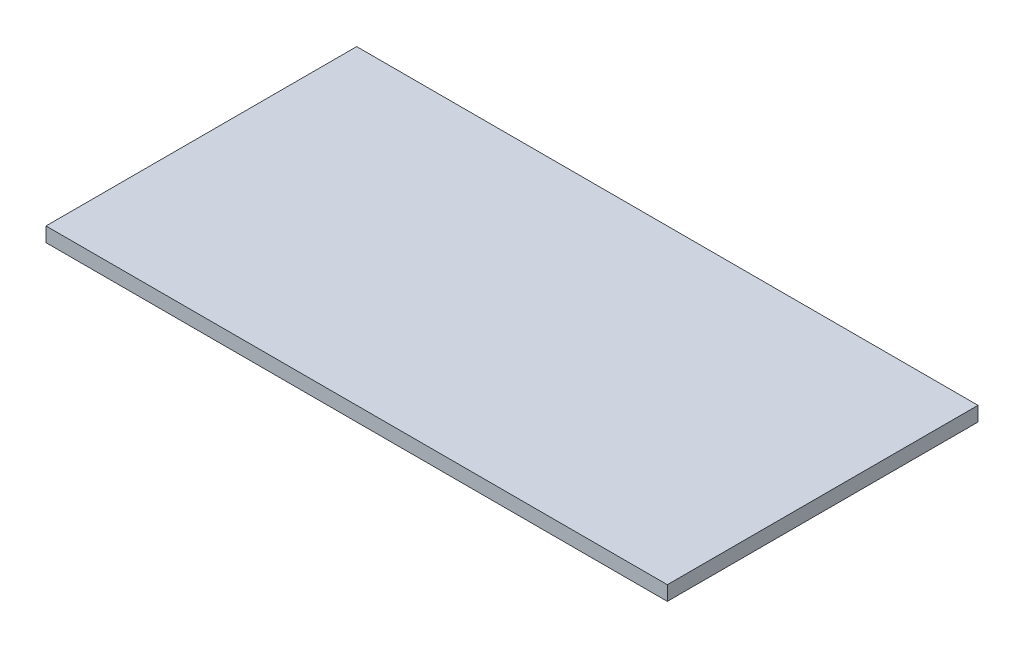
SolidWorks part; units mm, degrees
ref_plane "Front Plane" through (0, 0, 0) normal (0, 0, 1) x (1, 0, 0)
ref_plane "Top Plane" through (0, 0, 0) normal (0, 1, 0) x (1, 0, 0)
ref_plane "Right Plane" through (0, 0, 0) normal (1, 0, 0) x (0, 0, -1)
sketch "Sketch1" plane through (0, 0, 0) normal (0, 1, 0) x (1, 0, 0)
  line L1 (-560, 280) -> (560, 280)
  line L2 (-580, 260) -> (-580, -260)
  line L3 (-560, -280) -> (560, -280)
  line L4 (580, 260) -> (580, -260)
  line L5 (-580, 280) -> (580, -280) construction
  line L6 (-580, -280) -> (580, 280) construction
  arc A0 (560, 280) -> (580, 260) centre (560, 260) cw
  arc A1 (-580, -260) -> (-560, -280) centre (-560, -260) ccw
  arc A2 (-560, 280) -> (-580, 260) centre (-560, 260) ccw
  arc A3 (560, -280) -> (580, -260) centre (560, -260) ccw
  point P0 (0, 0)
  dimension "D3" = 20
  dimension "D1" = 560
  dimension "D2" = 1160
extrude "Boss-Extrude1" add sketch "Sketch1" against normal blind 5 draft 45
sketch "Sketch2" plane through (0, 0, 0) normal (0, 1, 0) x (1, 0, 0)
  line L1 (-600, 300) -> (600, 300)
  line L2 (-600, 300) -> (-600, -300)
  line L3 (-600, -300) -> (600, -300)
  line L4 (600, 300) -> (600, -300)
  line L5 (-600, 300) -> (600, -300) construction
  line L6 (-600, -300) -> (600, 300) construction
  point P0 (0, 0)
  dimension "D1" = 600
  dimension "D2" = 1200
extrude "Boss-Extrude2" add sketch "Sketch2" along normal blind 28
fillet "Fillet1" radius 2 16 edges at (-574.1421, 0, 274.1421) (-580, 0, 0) (-574.1421, 0, -274.1421) (0, 0, -280) (574.1421, 0, -274.1421) (580, 0, 0) (574.1421, 0, 274.1421) (0, -5, -275) (-570.6066, -5, -270.6066) (-575, -5, 0) (-570.6066, -5, 270.6066) (0, -5, 275) (570.6066, -5, 270.6066) (575, -5, 0) (570.6066, -5, -270.6066) (0, 0, 280)
sketch "Orientation Sketch" plane through (0, 0, 0) normal (0, -1, 0) x (-1, 0, 0)
  line L0 (580.8284, 260) -> (580.8284, -260) construction
  line L1 (560, -280.8284) -> (-560, -280.8284) construction
  line L2 (-580.8284, -260) -> (-580.8284, 260) construction
  line L3 (-560, 280.8284) -> (560, 280.8284) construction
  line L4 (-600, -300) -> (-600, 300) construction
  line L5 (600, -300) -> (-600, -300) construction
  line L6 (600, 300) -> (600, -300) construction
  line L7 (-600, 300) -> (600, 300) construction
  line L8 (580.8284, 260) -> (580.8284, -260)
  line L9 (560, -280.8284) -> (-560, -280.8284)
  line L10 (-580.8284, -260) -> (-580.8284, 260)
  line L11 (-560, 280.8284) -> (560, 280.8284)
  line L12 (-600, -300) -> (-600, 300) construction
  line L13 (600, -300) -> (-600, -300) construction
  line L14 (600, 300) -> (600, -300) construction
  line L15 (-600, 300) -> (600, 300) construction
  arc A0 (560, -280.8284) -> (580.8284, -260) centre (560, -260) ccw construction
  arc A1 (-580.8284, -260) -> (-560, -280.8284) centre (-560, -260) ccw construction
  arc A2 (-560, 280.8284) -> (-580.8284, 260) centre (-560, 260) ccw construction
  arc A3 (580.8284, 260) -> (560, 280.8284) centre (560, 260) ccw construction
  arc A4 (560, -280.8284) -> (580.8284, -260) centre (560, -260) ccw
  arc A5 (-580.8284, -260) -> (-560, -280.8284) centre (-560, -260) ccw
  arc A6 (-560, 280.8284) -> (-580.8284, 260) centre (-560, 260) ccw
  arc A7 (580.8284, 260) -> (560, 280.8284) centre (560, 260) ccw
  point P16 (0, 0)
other "FormTool1"
